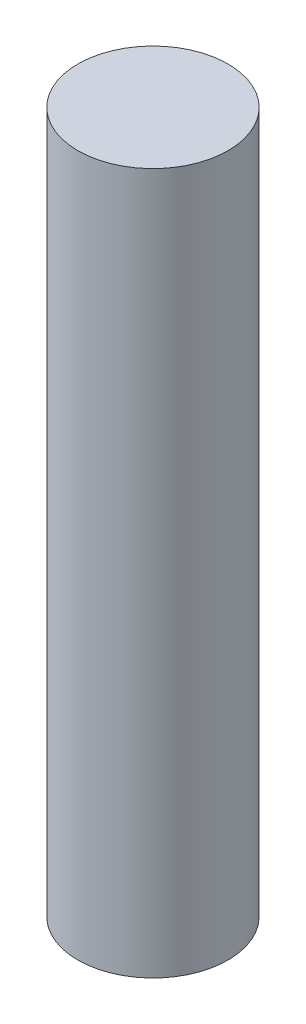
SolidWorks part; units mm, degrees
ref_plane "Front" through (0, 0, 0) normal (0, 0, 1) x (1, 0, 0)
ref_plane "Top" through (0, 0, 0) normal (0, 1, 0) x (1, 0, 0)
ref_plane "Right" through (0, 0, 0) normal (1, 0, 0) x (0, 0, -1)
sketch "Sketch1" plane through (0, 0, 0) normal (1, 0, 0) x (0, 0, -1)
  line L0 (0, 42.864) -> (0, -61.3146) construction
  line L1 (0, 0) -> (3, 0)
  line L2 (3, 0) -> (3, -28)
  line L3 (3, -28) -> (0, -28)
  line L4 (0, -28) -> (0, 0)
  dimension "D1" = 6
  dimension "D2" = 28
revolve "Revolve1" add sketch "Sketch1" angle 360 about L0
